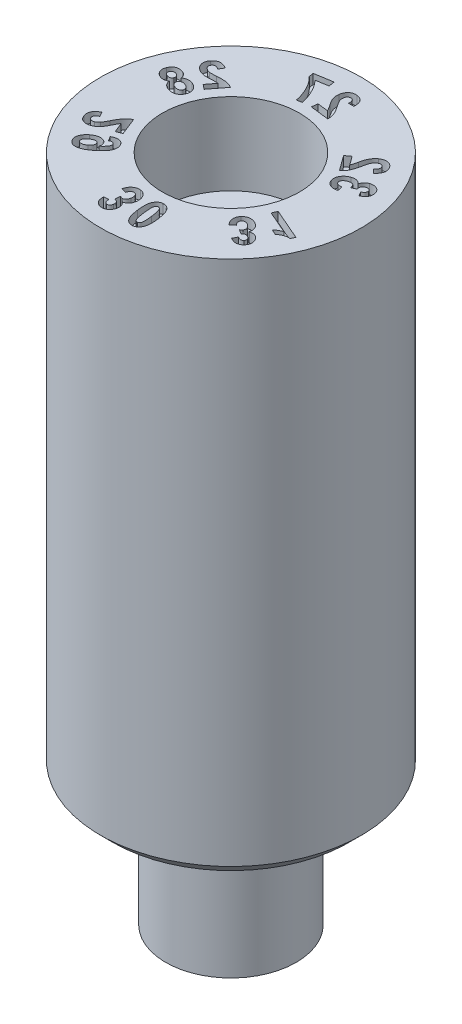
SolidWorks part; units mm, degrees
other "<M8L16-SetScrew>-<Chamfer1>" parameters "D10"=0.75
ref_plane "Front Plane" through (0, 0, 0) normal (0, 0, 1) x (1, 0, 0)
ref_plane "Top Plane" through (0, 0, 0) normal (0, 1, 0) x (1, 0, 0)
ref_plane "Right Plane" through (0, 0, 0) normal (1, 0, 0) x (0, 0, -1)
sketch "Sketch1" plane through (0, 0, 0) normal (0, 0, 1) x (1, 0, 0)
  line L0 (0, 0) -> (0, 20) construction
  line L1 (0, -8.8) -> (0, 8.8) construction
  line L2 (4, -33) -> (7.25, -33)
  line L4 (8, -32.25) -> (8, 0)
  line L5 (8, 0) -> (4.2, 0)
  line L6 (4.2, 0) -> (4.2, -5)
  line L7 (4.2, -5) -> (1.75, -5)
  line L8 (1.75, -5) -> (1.75, -23)
  line L9 (1.75, -23) -> (4, -23)
  line L10 (4, -23) -> (4, -33)
  line L11 (7.25, -33) -> (8, -32.25)
  point P6 (8, -33)
  dimension "D1" = 5
  dimension "D2" = 10
  dimension "D3" = 3.5
  dimension "D4" = 8.4
  dimension "D5" = 16
  dimension "D6" = 8
  dimension "D7" = 33
revolve "Revolve1" add sketch "Sketch1" angle 360 about L0
sketch "Sketch2" plane through (0, 0, 0) normal (0, 1, 0) x (1, 0, 0)
  line L0 (0, 0) -> (0, 8.4189) construction
  line L1 (0, 0) -> (7.291, 4.2094) construction
  line L2 (0, 0) -> (7.291, -4.2094) construction
  line L3 (0, 0) -> (0, -8.4189) construction
  line L4 (0, 0) -> (-7.291, -4.2094) construction
  line L5 (0, 0) -> (-7.291, 4.2094) construction
  arc A0 (1.2401, 4.7434) -> (2.4507, 4.2464) centre (0, 0) ccw construction
  text T0 "27   28   29   30   31   32" font "Arial Narrow" height 2.08
  point P13 (0, 0)
  point P16 (0, 0)
  point P17 (0, 0)
  point P21 (0, 0)
  dimension "D1" = 4.9028
  dimension "D2" = 6
extrude "Cut-Extrude1" cut sketch "Sketch2" against normal blind 0.6
inserted part "M8L16-SetScrew"
move or copy body "Body-Move/Copy2" placed by mates yes
other "Distance1" parameters "D1"=8
